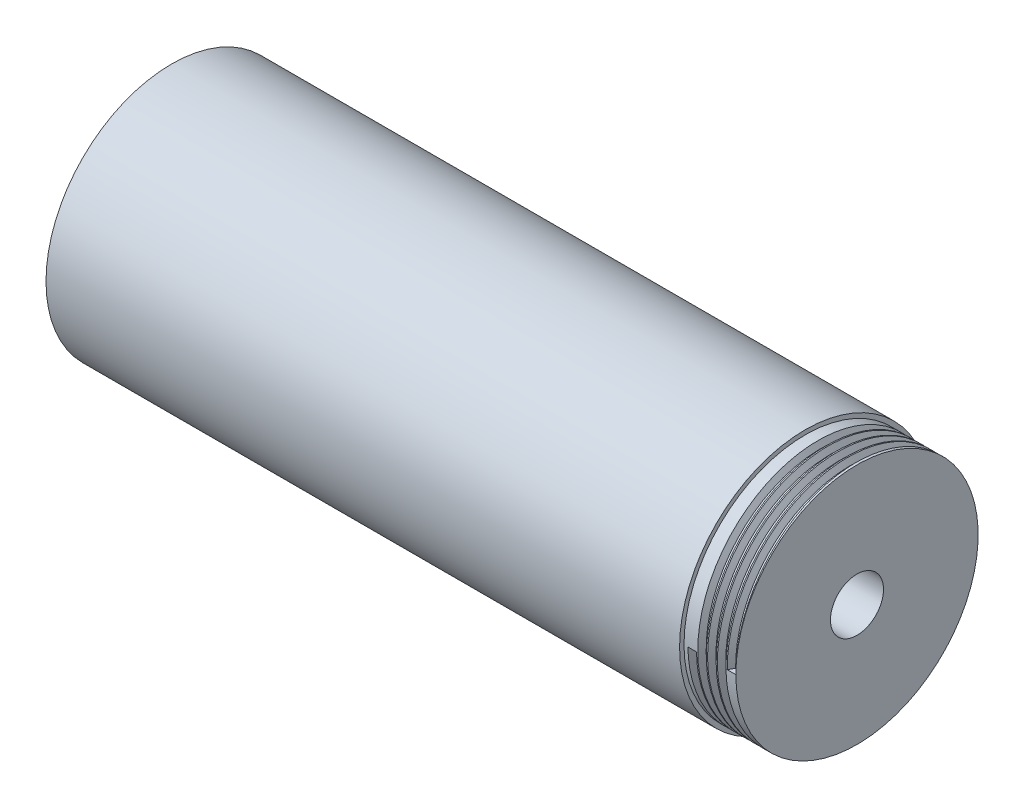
SolidWorks part; units mm, degrees
ref_plane "Frontal Plane" through (0, 0, 0) normal (0, 0, 1) x (1, 0, 0)
ref_plane "Horizontal Plane" through (0, 0, 0) normal (0, 1, 0) x (1, 0, 0)
ref_plane "Profile Plane" through (0, 0, 0) normal (1, 0, 0) x (0, 0, -1)
sketch "Sketch1" plane through (0, 0, 0) normal (0, 0, 1) x (1, 0, 0)
  line L11 (98.425, 0.635) -> (98.425, 14.224)
  line L14 (90.9828, 18.034) -> (68.4022, 18.034)
  line L15 (68.4022, 18.034) -> (68.4022, 2.54)
  line L16 (68.4022, 2.54) -> (0, 2.54)
  line L17 (0, 2.54) -> (0, 0)
  line L18 (0, 18.034) -> (85.725, 18.034) construction
  line L19 (98.425, 14.224) -> (90.9828, 14.224)
  line L20 (90.9828, 14.224) -> (90.9828, 18.034)
  line L21 (90.9828, 0) -> (0, 0)
  line L22 (90.9828, 0) -> (90.9828, 0.635)
  line L23 (90.9828, 0.635) -> (98.425, 0.635)
  point P1 (94.7039, 14.224)
  point P12 (0, 1.27)
  dimension "D1" = 98.425
  dimension "D2" = 68.4022
  dimension "D3" = 7.4422
  dimension "D4" = 2.54
  dimension "D5" = 3.81
  dimension "D6" = 18.034
  dimension "D7" = 0.635
  dimension "D8" = 7.4422
revolve "Revolve2" add sketch "Sketch1" angle 360 about L18
thread "Thread1" pitch 1.4111 start angle 0, offset 0, length 0, pitch 1.4111, diameter 34.798
ref_plane "Plane1" through (98.425, 18.034, 17.399) normal (0, -1, 0) x (0, 0, 1)
sketch "Thread Profile1" plane through (98.425, 18.034, 17.399) normal (0, -1, 0) x (0, 0, 1)
  line L0 (0, 0) -> (0, 1.4111) construction
  line L11 (0, 0) -> (0, 1.2347)
  line L12 (0, 1.2347) -> (-0.7638, 0.7937)
  line L13 (-0.7638, 0.7937) -> (-0.7638, 0.441)
  line L15 (-0.7638, 0.441) -> (0, 0)
  line L17 (-0.7638, 0.6174) -> (0, 0.6174) construction
  point P2 (0, 0)
  dimension "Pitch" = 1.4111
  dimension "Profile_Angle" = 60
  dimension "Profile_Land" = 0.3528
  dimension "Profile_Height" = 0.7638
thread "Thread2" pitch 1.27 start angle 0, offset 0, length 0, pitch 1.27, diameter 30.988
ref_plane "Plane2" through (0, 18.034, -15.494) normal (0, -1, 0) x (0, 0, -1)
sketch "Thread Profile2" plane through (0, 18.034, -15.494) normal (0, -1, 0) x (0, 0, -1)
  line L0 (0, 0) -> (0, 1.27) construction
  line L11 (0, 0) -> (0, 1.1112)
  line L12 (0, 1.1112) -> (-0.6874, 0.7144)
  line L13 (-0.6874, 0.7144) -> (-0.6874, 0.3969)
  line L15 (-0.6874, 0.3969) -> (0, 0)
  line L17 (-0.6874, 0.5556) -> (0, 0.5556) construction
  point P2 (0, 0)
  dimension "Pitch" = 1.27
  dimension "Profile_Angle" = 60
  dimension "Profile_Land" = 0.3175
  dimension "Profile_Height" = 0.6874
ref_plane "Plane3" through (0, 0, 0) normal (0, -1, 0) x (-1, 0, 0)
sketch "Sketch2" plane through (0, 0, 0) normal (0, -1, 0) x (-1, 0, 0)
  line L0 (-98.425, 17.399) -> (-98.425, -17.399) construction
  line L1 (-90.9828, -18.034) -> (0, -18.034) construction
  circle A0 centre (-75.946, 0) radius 4.5974
  dimension "D1" = 9.1948
  dimension "D2" = 22.479
  dimension "D3" = 18.034
extrude "Cut-Extrude1" cut sketch "Sketch2" against normal blind 1.016
